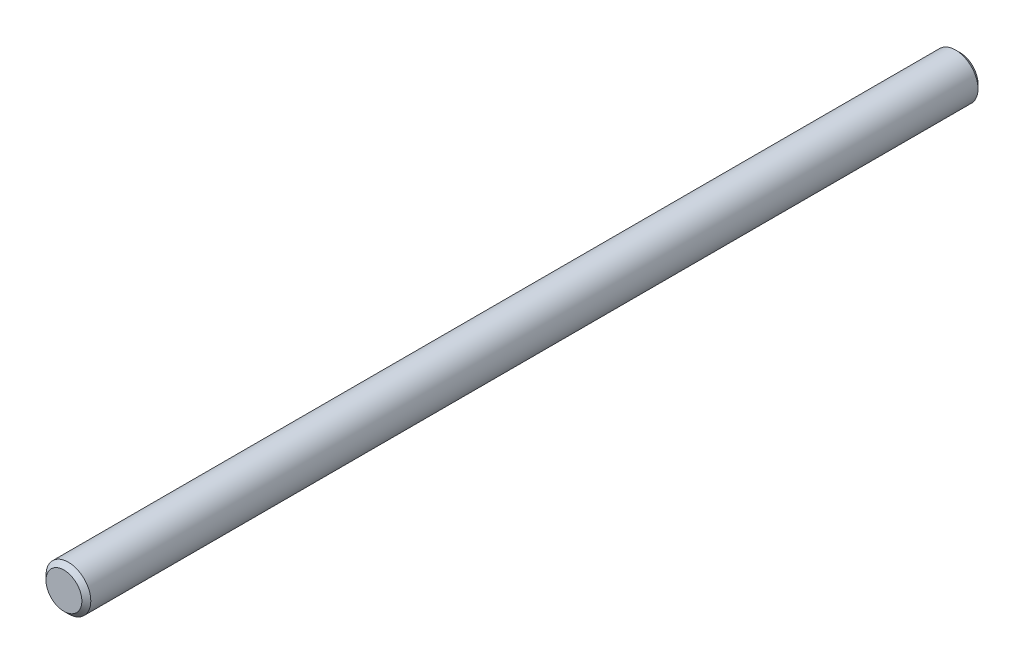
SolidWorks part; units mm, degrees
ref_plane "Face" through (0, 0, 0) normal (0, 0, 1) x (1, 0, 0)
ref_plane "Dessus" through (0, 0, 0) normal (0, 1, 0) x (1, 0, 0)
ref_plane "Droite" through (0, 0, 0) normal (1, 0, 0) x (0, 0, -1)
sketch "Esquisse1" plane through (0, 0, 0) normal (0, 0, 1) x (1, 0, 0)
  circle A0 centre (0, 0) radius 1
  dimension "D1" = 2
extrude "Extrusion1" add sketch "Esquisse1" along normal blind 40
chamfer "Chanfrein1" distance 0.2 angle 45 2 edges at (1, 0, 0) (1, 0, 40)
